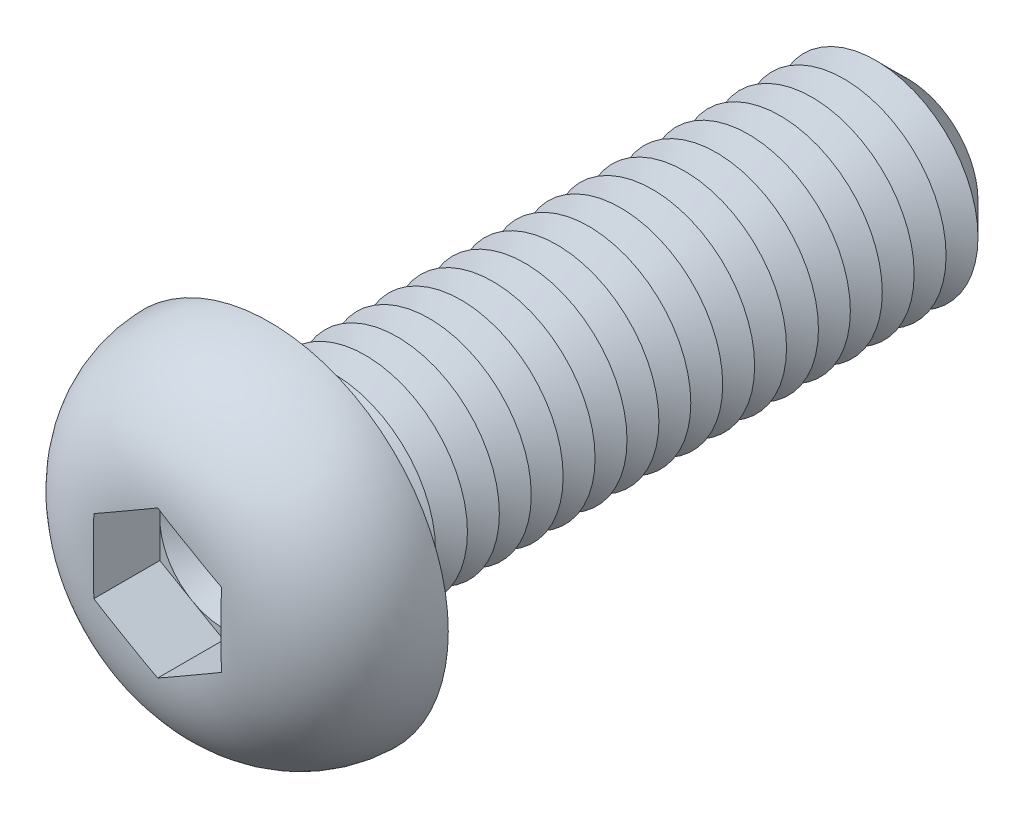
SolidWorks part; units mm, degrees
ref_plane "Front Plane" through (0, 0, 0) normal (0, 0, 1) x (1, 0, 0)
ref_plane "Top Plane" through (0, 0, 0) normal (0, 1, 0) x (1, 0, 0)
ref_plane "Right Plane" through (0, 0, 0) normal (1, 0, 0) x (0, 0, -1)
sketch "Sketch1" plane through (0, 0, 0) normal (1, 0, 0) x (0, 0, -1)
  line L0 (-47.9342, 0) -> (60.3146, 0) construction
sketch "Sketch2" plane through (0, 0, 0) normal (1, 0, 0) x (0, 0, -1)
  line L0 (0, 0) -> (-4.4, 0)
  line L1 (-47.9342, 0) -> (60.3146, 0) construction
  line L2 (-4.4, 0) -> (-4.4, 2.5011)
  line L3 (0, 7) -> (0, 0)
  arc A0 (-4.4, 2.5011) -> (0, 7) centre (0.1, 2.5011) cw
  dimension "D1" = 4.5
  dimension "D2" = 4.4
  dimension "D3" = 7
revolve "Revolve1" add sketch "Sketch2" angle 360 about L0
sketch "Sketch3" plane through (0, 0, 4.4) normal (0, 0, 1) x (1, 0, 0)
  line L1 (0, 2.8868) -> (-2.5, 1.4434)
  line L2 (-2.5, 1.4434) -> (-2.5, -1.4434)
  line L3 (-2.5, -1.4434) -> (0, -2.8868)
  line L4 (0, -2.8868) -> (2.5, -1.4434)
  line L5 (2.5, -1.4434) -> (2.5, 1.4434)
  line L6 (2.5, 1.4434) -> (0, 2.8868)
  circle A0 centre (0, 0) radius 2.5 construction
  dimension "D1" = 5
extrude "Cut-Extrude1" cut sketch "Sketch3" against normal blind 2.6
sketch "Sketch4" plane through (0, 0, 0) normal (0, 0, -1) x (-1, 0, 0)
  circle A0 centre (0, 0) radius 4
  dimension "D1" = 8
extrude "Boss-Extrude1" add sketch "Sketch4" along normal blind 25
chamfer "Chamfer1" distance 1.25 angle 45 1 edges at (-4, 0, -25)
sketch "Sketch5" plane through (0, 0, 0) normal (1, 0, 0) x (0, 0, -1)
  line L0 (1.25, 4) -> (2.5, 4)
  line L1 (23.75, 4) -> (0, 4) construction
  line L2 (2.5, 4) -> (1.875, 2.9175)
  line L3 (1.875, 2.9175) -> (1.25, 4)
  line L4 (0, -7) -> (0, 7) construction
  line L5 (23.75, 4) -> (0, 4) construction
  dimension "D1" = 1.25
  dimension "D2" = 1.25
revolve "Cut-Revolve1" cut sketch "Sketch5" angle 360 about L0
pattern_linear "LPattern1" count 18 spacing 1.25 along (0, 0, -1) of "Cut-Revolve1"
fillet "Fillet2" radius 0.5 1 edges at (4, 0, 0)
sketch "Sketch6" plane through (0, 0, 1.8) normal (0, 0, 1) x (1, 0, 0)
  line L0 (0, -2.8868) -> (2.5, -1.4434) construction
  circle A0 centre (0, 0) radius 2.5
extrude "Cut-Extrude2" cut sketch "Sketch6" against normal through all draft 60
